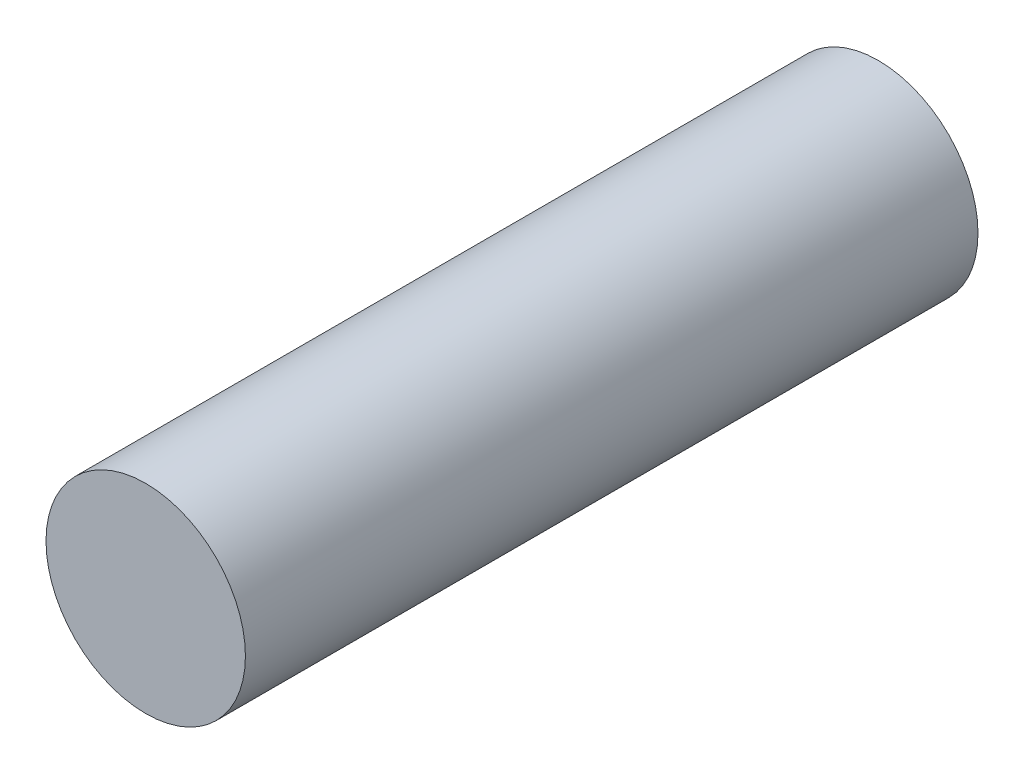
SolidWorks part; units mm, degrees
ref_plane "Front Plane" through (0, 0, 0) normal (0, 0, 1) x (1, 0, 0)
ref_plane "Top Plane" through (0, 0, 0) normal (0, 1, 0) x (1, 0, 0)
ref_plane "Right Plane" through (0, 0, 0) normal (1, 0, 0) x (0, 0, -1)
sketch "Sketch2" plane through (0, 0, 0) normal (0, 0, 1) x (1, 0, 0)
  circle A0 centre (0, 0) radius 2.45
  dimension "D1" = 4.9
extrude "Boss-Extrude1" add sketch "Sketch2" along normal blind 18
